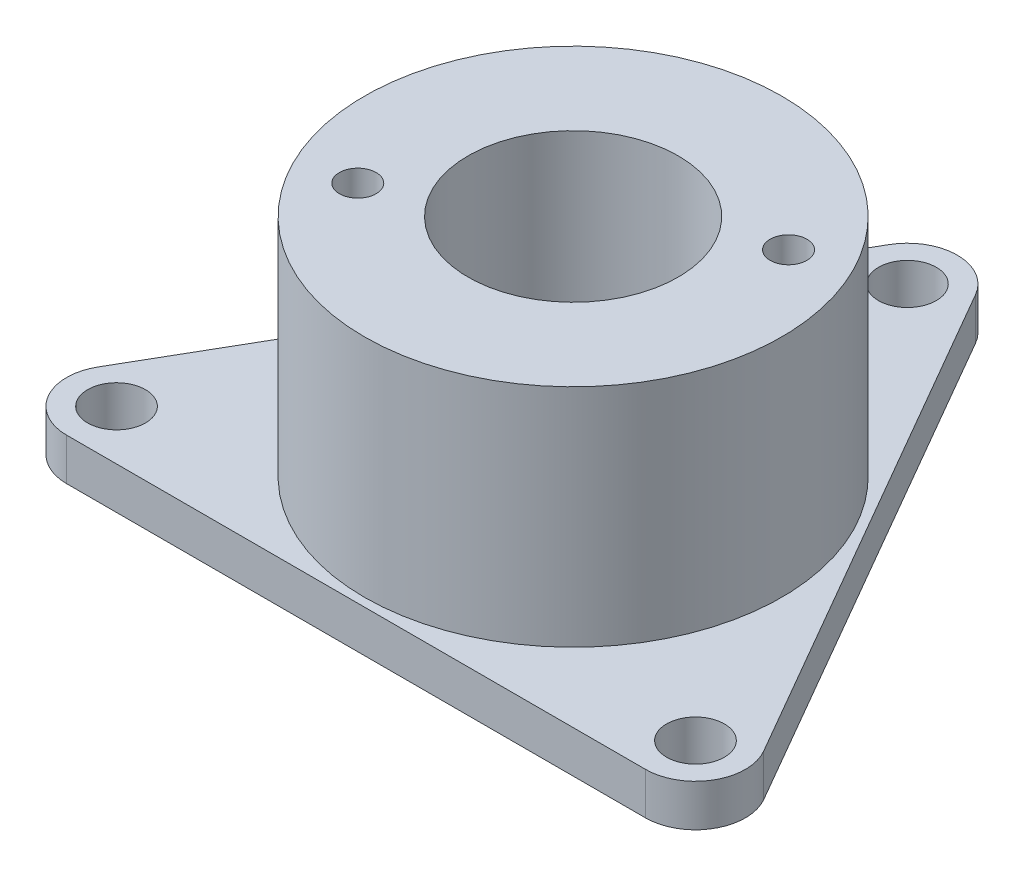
SolidWorks part; units mm, degrees
ref_plane "Front Plane" through (0, 0, 0) normal (0, 0, 1) x (1, 0, 0)
ref_plane "Top Plane" through (0, 0, 0) normal (0, 1, 0) x (1, 0, 0)
ref_plane "Right Plane" through (0, 0, 0) normal (1, 0, 0) x (0, 0, -1)
sketch "Sketch1" plane through (0, 0, 0) normal (0, 1, 0) x (1, 0, 0)
  line L0 (-27.5403, -15.9004) -> (0, 0) construction
  line L1 (0, 0) -> (27.5403, -15.9004) construction
  line L2 (0, 0) -> (0, 31.8008) construction
  line L3 (-4.1136, 34.1758) -> (-31.6539, -13.5254)
  line L4 (-27.5403, -20.6504) -> (27.5403, -20.6504)
  line L5 (31.6539, -13.5254) -> (4.1136, 34.1758)
  circle A0 centre (0, 0) radius 15.75
  circle A1 centre (0, 0) radius 31.8008 construction
  circle A2 centre (0, 31.8008) radius 2.75
  circle A3 centre (27.5403, -15.9004) radius 2.75
  circle A4 centre (-27.5403, -15.9004) radius 2.75
  arc A5 (-31.6539, -13.5254) -> (-27.5403, -20.6504) centre (-27.5403, -15.9004) ccw
  arc A6 (27.5403, -20.6504) -> (31.6539, -13.5254) centre (27.5403, -15.9004) ccw
  arc A7 (4.1136, 34.1758) -> (-4.1136, 34.1758) centre (0, 31.8008) ccw
  dimension "D3" = 5.5
  dimension "D4" = 5.5
  dimension "D5" = 5.5
  dimension "D7" = 31.5
  dimension "D8" = 2
  dimension "D9" = 2
  dimension "D10" = 2
  dimension "D1" = 120
  dimension "D2" = 120
  dimension "D6" = 31.8008
extrude "Boss-Extrude1" add sketch "Sketch1" along normal blind 4
sketch "Sketch2" plane through (0, 4, 0) normal (0, 1, 0) x (1, 0, 0)
  circle A0 centre (0, 0) radius 10
  circle A1 centre (0, 0) radius 19.8475
  dimension "D1" = 20
extrude "Boss-Extrude2" add sketch "Sketch2" along normal blind 21.46
sketch "Sketch3" plane through (0, 25.46, 0) normal (0, 1, 0) x (1, 0, 0)
  line L0 (12.9904, 7.5) -> (-12.9904, -7.5) construction
  line L1 (-6.8686, 0) -> (7.2301, 0) construction
  circle A0 centre (0, 0) radius 15 construction
  circle A1 centre (12.9904, 7.5) radius 1.75
  circle A2 centre (-12.9904, -7.5) radius 1.75
  point P7 (-12.8933, -7.6656)
  point P9 (0, 0)
  dimension "D1" = 30
  dimension "D2" = 3.5
  dimension "D3" = 3.5
  dimension "D4" = 30
extrude "Cut-Extrude1" cut sketch "Sketch3" against normal blind 20.574 contours A2 | A1
chamfer "Chamfer1" distance 5.588 angle 17 1 edges at (0, 4, 15.75)
